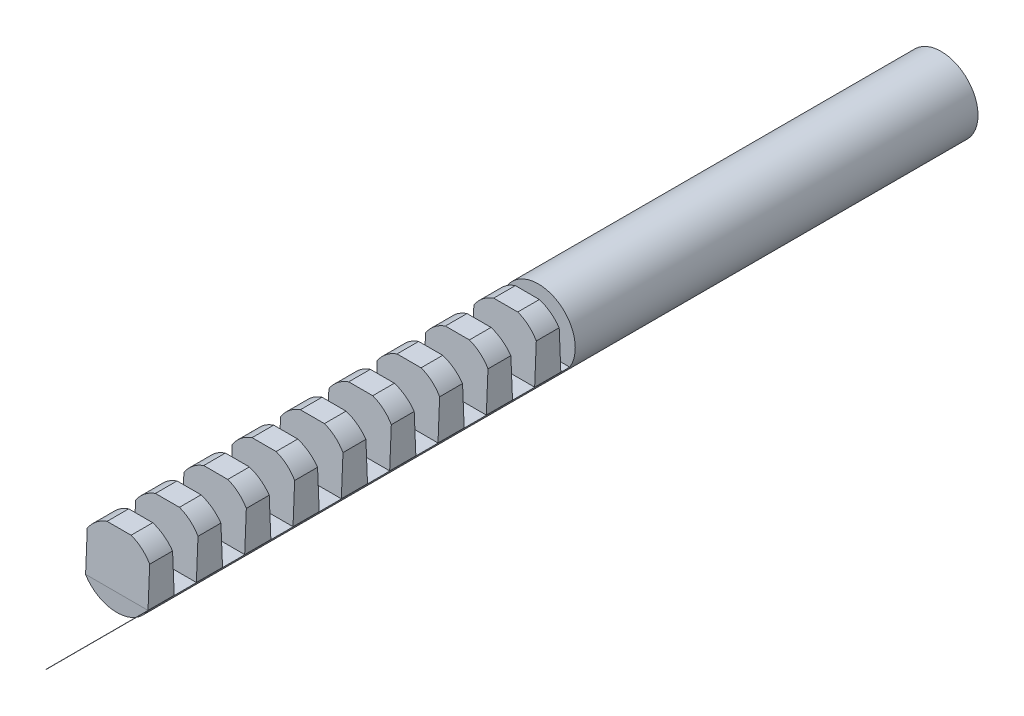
SolidWorks part; units mm, degrees
ref_plane "Front Plane" through (0, 0, 0) normal (0, 0, 1) x (1, 0, 0)
ref_plane "Top Plane" through (0, 0, 0) normal (0, 1, 0) x (1, 0, 0)
ref_plane "Right Plane" through (0, 0, 0) normal (1, 0, 0) x (0, 0, -1)
sketch "Sketch1" plane through (0, 0, 0) normal (0, 0, 1) x (1, 0, 0)
  circle A0 centre (0, 0) radius 2.75
  dimension "D1" = 5.5
  dimension "D2" = 5.5
extrude "Boss-Extrude1" add sketch "Sketch1" along normal blind 20 and the other way blind 10
sketch "Sketch2" plane through (0, 0, 20) normal (0, 0, 1) x (1, 0, 0)
  line L0 (-2.75, 0) -> (2.75, 0) construction
  line L1 (0, 2.75) -> (0, -2.75) construction
  line L3 (-2.3367, -1.45) -> (2.3367, -1.45)
  arc A0 (-2.3367, -1.45) -> (2.3367, -1.45) centre (0, 0) ccw
extrude "Boss-Extrude2" add sketch "Sketch2" along normal blind 39
sketch "Sketch4" plane through (0, 0, 0) normal (1, 0, 0) x (0, 0, -1)
  line L0 (-53.05, -1.45) -> (-55, -1.45)
  line L3 (-54.025, -1.45) -> (-54.025, 2.6) construction
  line L4 (-53.2188, 2.6) -> (-54.8313, 2.6)
  line L6 (-53.2188, 2.6) -> (-53.05, -1.45)
  line L8 (-54.8313, 2.6) -> (-55, -1.45)
extrude "Boss-Extrude3" add sketch "Sketch4" along normal mid plane 4.65
sketch "Sketch5" plane through (0, 0, 59) normal (0, 0, 1) x (1, 0, 0)
  line L0 (-2.325, 1.4686) -> (-2.325, 2.6)
  line L2 (-2.325, 2.6) -> (-0.8958, 2.6)
  line L4 (0.8958, 2.6) -> (2.325, 2.6)
  line L5 (2.325, 2.6) -> (2.325, 1.4686)
  arc A2 (-0.8958, 2.6) -> (-2.325, 1.4686) centre (0, 0) ccw
  arc A3 (2.325, 1.4686) -> (0.8958, 2.6) centre (0, 0) ccw
extrude "Cut-Extrude1" cut sketch "Sketch5" against normal through all both and the other way through all
pattern_linear "LPattern10" count 10 spacing 3.6 along (0, 0, -1) of "Boss-Extrude3", "Cut-Extrude1"
pattern_linear "LPattern12" count 2 spacing 3.6 along (0, 0, 1) of "Boss-Extrude3", "Cut-Extrude1"
sketch "Sketch6" plane through (0, 2.6, 0) normal (0, 1, 0) x (1, 0, 0)
  line L1 (-2.3367, -59) -> (2.325, -59)
  line L2 (-2.3367, -59) -> (-2.3367, -51.4)
  line L3 (-2.3367, -51.4) -> (2.325, -51.4)
  line L4 (2.325, -59) -> (2.325, -51.4)
extrude "Cut-Extrude2" cut sketch "Sketch6" against normal blind 10
sketch "Sketch7" plane through (0, 0, -10) normal (0, 0, -1) x (-1, 0, 0)
  circle A0 centre (0, 0) radius 1.5
extrude "Cut-Extrude3" cut sketch "Sketch7" against normal blind 20
